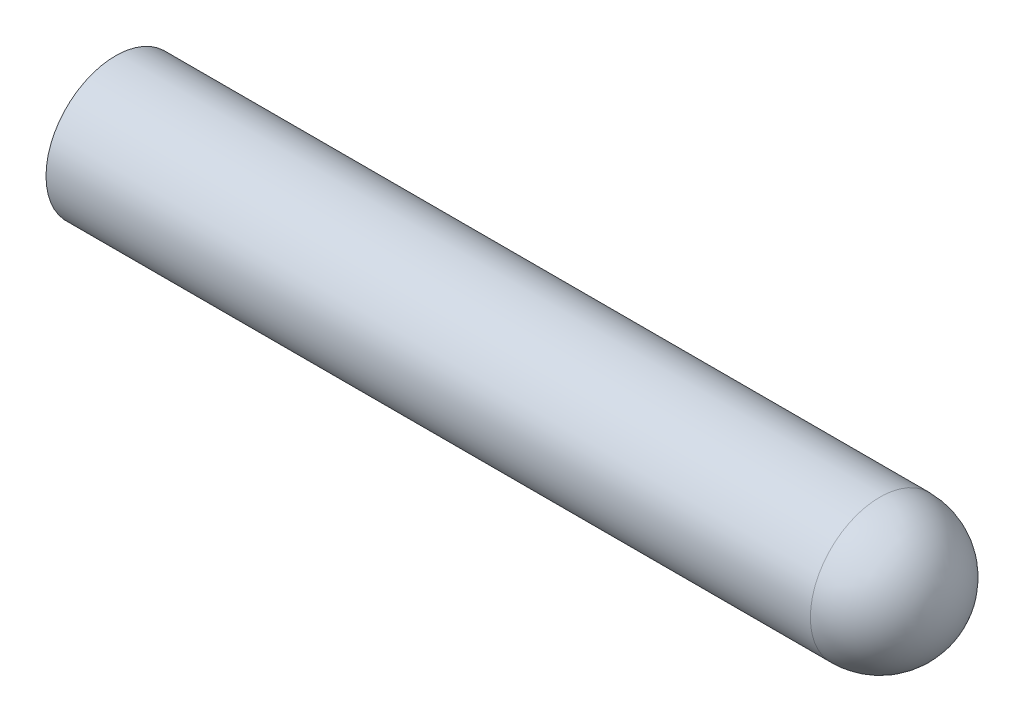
SolidWorks part; units mm, degrees
ref_plane "Plan de face" through (0, 0, 0) normal (0, 0, 1) x (1, 0, 0)
ref_plane "Plan de dessus" through (0, 0, 0) normal (0, 1, 0) x (1, 0, 0)
ref_plane "Plan de droite" through (0, 0, 0) normal (1, 0, 0) x (0, 0, -1)
sketch "Esquisse1" plane through (0, 0, 0) normal (0, 0, 1) x (1, 0, 0)
  line L1 (0, 0) -> (60, 0)
  line L2 (0, 0) -> (0, 5)
  line L3 (0, 5) -> (55, 5)
  arc A0 (60, 0) -> (55, 5) centre (55, 0) ccw
  dimension "D1" = 5
  dimension "D2" = 55
revolve "Révolution1" add sketch "Esquisse1" angle 360 about L1
